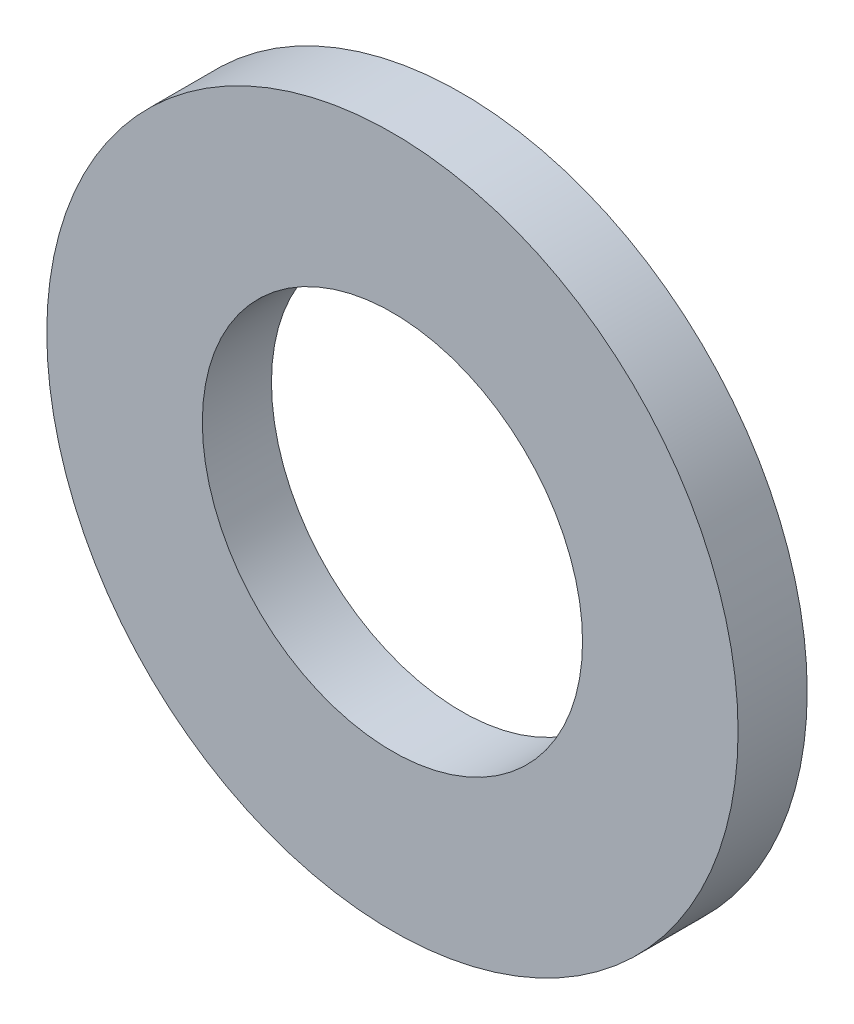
SolidWorks part; units mm, degrees
ref_plane "Plan1" through (0, 0, 0) normal (0, 0, 1) x (1, 0, 0)
ref_plane "Plan2" through (0, 0, 0) normal (0, 1, 0) x (1, 0, 0)
ref_plane "Plan3" through (0, 0, 0) normal (1, 0, 0) x (0, 0, -1)
sketch "Esquisse1" plane through (0, 0, 0) normal (0, 0, 1) x (1, 0, 0)
  circle A0 centre (0, 0) radius 5
  dimension "D1" = 10
extrude "Base-Extrusion" add sketch "Esquisse1" along normal blind 1
sketch "Esquisse2" plane through (0, 0, 0) normal (0, 0, -1) x (-1, 0, 0)
  circle A0 centre (0, 0) radius 2.75
  dimension "D1" = 5.5
extrude "Enlèv. mat.-Extru.1" cut sketch "Esquisse2" against normal blind 1
